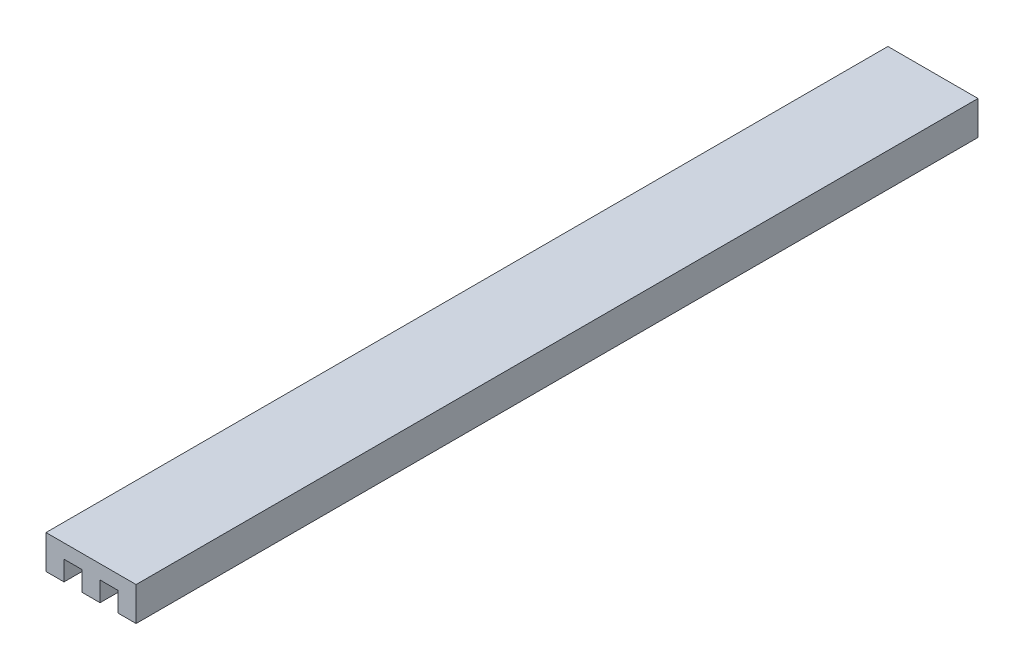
SolidWorks part; units mm, degrees
ref_plane "Plan de face" through (0, 0, 0) normal (0, 0, 1) x (1, 0, 0)
ref_plane "Plan de dessus" through (0, 0, 0) normal (0, 1, 0) x (1, 0, 0)
ref_plane "Plan de droite" through (0, 0, 0) normal (1, 0, 0) x (0, 0, -1)
sketch "Esquisse1" plane through (0, 0, 0) normal (0, 0, 1) x (1, 0, 0)
  line L0 (-35.1249, 0) -> (39.8324, 0) construction
  line L1 (-33.1333, -6) -> (62.1023, -6) construction
  line L2 (0, 11.8592) -> (0, -15.6614) construction
  line L3 (16, 11.8592) -> (16, -15.6614) construction
  line L4 (12.8, 4.979) -> (12.8, -13.4887) construction
  line L5 (9.6, 4.979) -> (9.6, -13.4887) construction
  line L6 (6.4, 4.979) -> (6.4, -13.4887) construction
  line L7 (3.2, 4.979) -> (3.2, -13.4887) construction
  line L8 (-10.8634, -2.5) -> (28.4258, -2.5) construction
  line L9 (16, 0) -> (16, -6)
  line L10 (16, -6) -> (12.8, -6)
  line L11 (12.8, -6) -> (12.8, -2.5)
  line L12 (12.8, -2.5) -> (9.6, -2.5)
  line L13 (9.6, -2.5) -> (9.6, -6)
  line L14 (9.6, -6) -> (6.4, -6)
  line L15 (6.4, -6) -> (6.4, -2.5)
  line L16 (6.4, -2.5) -> (3.2, -2.5)
  line L17 (3.2, -2.5) -> (3.2, -6)
  line L18 (3.2, -6) -> (0, -6)
  line L19 (0, -6) -> (0, 0)
  line L20 (0, 0) -> (16, 0)
  dimension "D1" = 6
  dimension "D2" = 16
  dimension "D3" = 3.2
  dimension "D4" = 3.2
  dimension "D5" = 3.2
  dimension "D6" = 3.2
  dimension "D7" = 3.2
  dimension "D8" = 3.5
extrude "Boss.-Extru.1" add sketch "Esquisse1" along normal blind 149.5
